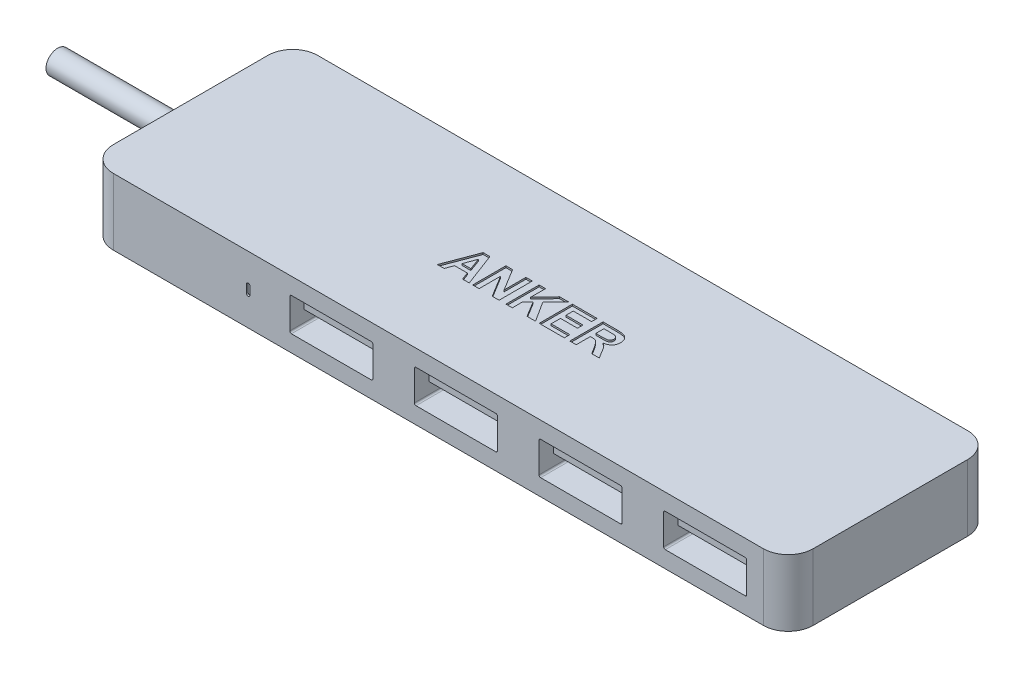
SolidWorks part; units mm, degrees
ref_plane "Front Plane" through (0, 0, 0) normal (0, 0, 1) x (1, 0, 0)
ref_plane "Top Plane" through (0, 0, 0) normal (0, 1, 0) x (1, 0, 0)
ref_plane "Right Plane" through (0, 0, 0) normal (1, 0, 0) x (0, 0, -1)
sketch "Sketch1" plane through (0, 0, 0) normal (0, 1, 0) x (1, 0, 0)
  line L1 (-53.4924, 15.621) -> (53.4924, 15.621)
  line L2 (-53.4924, 15.621) -> (-53.4924, -15.621)
  line L3 (-53.4924, -15.621) -> (53.4924, -15.621)
  line L4 (53.4924, 15.621) -> (53.4924, -15.621)
  line L5 (-53.4924, 15.621) -> (53.4924, -15.621) construction
  line L6 (-53.4924, -15.621) -> (53.4924, 15.621) construction
  point P0 (0, 0)
  dimension "D1" = 106.9848
  dimension "D2" = 31.242
extrude "Boss-Extrude1" add sketch "Sketch1" along normal blind 10.16
fillet "Fillet1" radius 3.81 4 edges at (-53.4924, 5.08, -15.621) (-53.4924, 5.08, 15.621) (53.4924, 5.08, -15.621) (53.4924, 5.08, 15.621)
sketch "Sketch2" plane through (-53.4924, 0, 0) normal (-1, 0, 0) x (0, 0, 1)
  line L0 (-11.811, 10.16) -> (-11.811, 0) construction
  line L1 (-10.541, 8.509) -> (10.541, 8.509)
  line L2 (-10.541, 8.509) -> (-10.541, 1.651)
  line L3 (-10.541, 1.651) -> (10.541, 1.651)
  line L4 (10.541, 8.509) -> (10.541, 1.651)
  line L5 (11.811, 0) -> (11.811, 10.16) construction
  line L6 (-11.811, 10.16) -> (11.811, 10.16) construction
  line L7 (-11.811, 0) -> (11.811, 0) construction
  dimension "D1" = 1.27
  dimension "D2" = 1.27
  dimension "D3" = 1.651
  dimension "D4" = 1.651
extrude "Cut-Extrude1" cut sketch "Sketch2" against normal blind 5.08
chamfer "Chamfer1" distance 5.08 angle 60 2 edges at (-48.4124, 5.08, 10.541) (-48.4124, 5.08, -10.541)
fillet "Fillet2" radius 3.81 2 edges at (-53.4924, 5.08, 10.541) (-53.4924, 5.08, -10.541)
sketch "Sketch3" plane through (-48.4124, 0, 0) normal (-1, 0, 0) x (0, 0, 1)
  line L0 (-11.811, 0) -> (11.811, 0) construction
  circle A0 centre (0, 5.08) radius 1.778
  dimension "D1" = 3.556
  dimension "D2" = 5.08
extrude "Boss-Extrude2" add sketch "Sketch3" along normal blind 25.4
sketch "Sketch4" plane through (0, 0, 15.621) normal (0, 0, 1) x (1, 0, 0)
  line L0 (-49.6824, 0) -> (49.6824, 0) construction
  line L1 (34.4424, 7.62) -> (47.1424, 7.62)
  line L2 (34.4424, 7.62) -> (34.4424, 2.54)
  line L3 (34.4424, 2.54) -> (47.1424, 2.54)
  line L4 (47.1424, 7.62) -> (47.1424, 2.54)
  line L5 (34.4424, 7.62) -> (47.1424, 2.54) construction
  line L6 (34.4424, 2.54) -> (47.1424, 7.62) construction
  line L7 (53.4924, 10.16) -> (53.4924, 0) construction
  point P0 (40.7924, 5.08)
  dimension "D1" = 12.7
  dimension "D2" = 5.08
  dimension "D3" = 5.08
  dimension "D4" = 12.7
extrude "Cut-Extrude2" cut sketch "Sketch4" against normal blind 12.7
fillet "Fillet3" radius 0.254 4 edges at (47.1424, 2.54, 9.271) (47.1424, 7.62, 9.271) (34.4424, 7.62, 9.271) (34.4424, 2.54, 9.271)
pattern_linear "LPattern1" count 4 spacing 19.05 along (-1, 0, 0) of "Cut-Extrude2", "Fillet3"
sketch "Sketch5" plane through (0, 0, 2.921) normal (0, 0, 1) x (1, 0, 0)
  line L0 (46.8884, 7.62) -> (34.6964, 7.62) construction
  line L1 (35.0774, 6.731) -> (46.5074, 6.731)
  line L2 (35.0774, 6.731) -> (35.0774, 5.461)
  line L3 (35.0774, 5.461) -> (46.5074, 5.461)
  line L4 (46.5074, 6.731) -> (46.5074, 5.461)
  line L5 (35.0774, 6.731) -> (46.5074, 5.461) construction
  line L6 (35.0774, 5.461) -> (46.5074, 6.731) construction
  line L7 (47.1424, 2.794) -> (47.1424, 7.366) construction
  point P0 (40.7924, 6.096)
  dimension "D1" = 1.27
  dimension "D2" = 11.43
  dimension "D3" = 1.524
  dimension "D4" = 6.35
extrude "Boss-Extrude4" add sketch "Sketch5" along normal blind 11.43
chamfer "Chamfer2" distance 0.508 angle 30 2 edges at (46.5074, 6.096, 14.351) (35.0774, 6.096, 14.351)
pattern_linear "LPattern2" count 4 spacing 19.05 along (-1, 0, 0) of "Boss-Extrude4", "Chamfer2"
sketch "Sketch6" plane through (0, 0, 15.621) normal (0, 0, 1) x (1, 0, 0)
  line L0 (-29.0576, 5.715) -> (-29.0576, 4.445) construction
  line L1 (-28.8036, 5.715) -> (-28.8036, 4.445)
  line L2 (-29.3116, 5.715) -> (-29.3116, 4.445)
  line L3 (-49.6824, 10.16) -> (49.6824, 10.16) construction
  line L4 (-22.7076, 7.366) -> (-22.7076, 2.794) construction
  arc A0 (-28.8036, 5.715) -> (-29.3116, 5.715) centre (-29.0576, 5.715) ccw
  arc A1 (-29.3116, 4.445) -> (-28.8036, 4.445) centre (-29.0576, 4.445) ccw
  point P2 (-29.0576, 5.08)
  dimension "D1" = 5.08
  dimension "D2" = 1.27
  dimension "D3" = 0.508
  dimension "D4" = 6.35
extrude "Cut-Extrude3" cut sketch "Sketch6" against normal blind 0.254
sketch "Sketch7" plane through (0, 10.16, 0) normal (0, 1, 0) x (1, 0, 0)
  line L0 (-49.6824, -15.621) -> (49.6824, -15.621) construction
  line L1 (-53.4924, 11.811) -> (-53.4924, -11.811) construction
  text T0 "ANKER" font "Arial" height 5.08
  dimension "D1" = 12.7
  dimension "D2" = 40.64
extrude "Cut-Extrude5" cut sketch "Sketch7" against normal blind 0.254
